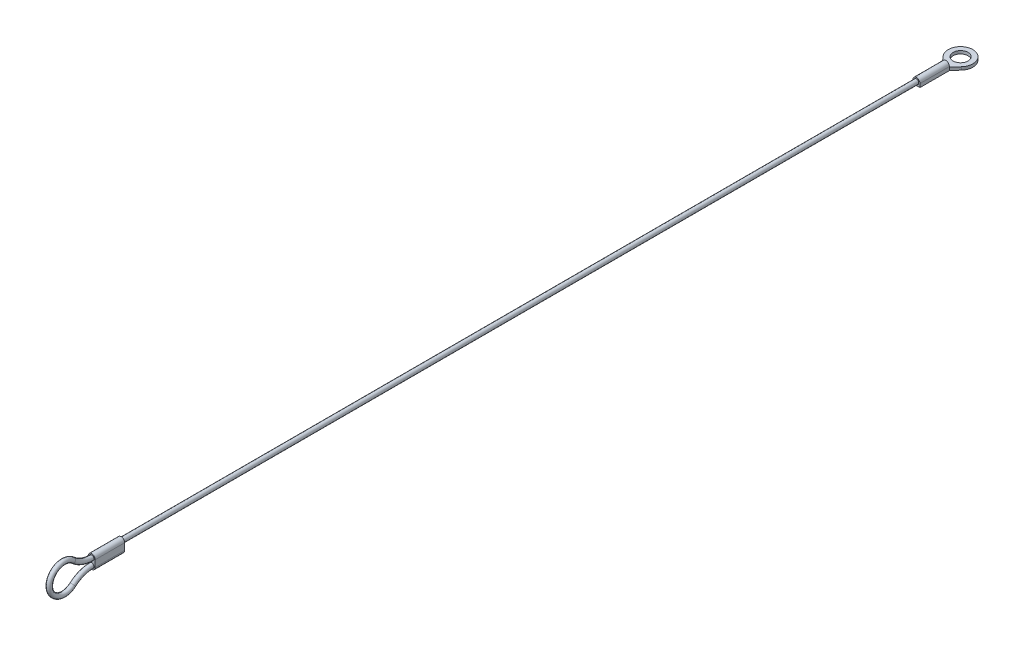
SolidWorks part; units mm, degrees
ref_plane "Front Plane" through (0, 0, 0) normal (0, 0, 1) x (1, 0, 0)
ref_plane "Top Plane" through (0, 0, 0) normal (0, 1, 0) x (1, 0, 0)
ref_plane "Right Plane" through (0, 0, 0) normal (1, 0, 0) x (0, 0, -1)
sketch "Sketch1" plane through (0, 0, 0) normal (1, 0, 0) x (0, 0, -1)
  line L2 (-280.2, 0) -> (0, 0)
  arc A0 (-280.2, 0) -> (-286.6, 2.4446) centre (-280.2, 9.6) cw
  arc A1 (-286.6, 2.4446) -> (-286.6, -4.7108) centre (-289.8, -1.1331) ccw
  arc A2 (-286.6, -4.7108) -> (-280.2, -2.2663) centre (-280.2, -11.8663) cw
  dimension "D1" = 4.8
  dimension "D4" = 9.6
  dimension "D2" = 289.8
  dimension "D3" = 9.6
sketch "Sketch2" plane through (0, 0, 0) normal (0, 0, 1) x (1, 0, 0)
  circle A0 centre (0, 0) radius 0.795
  dimension "D1" = 1.59
sweep "Sweep1" add profiles "Sketch2" path "Sketch1"
sketch "Sketch3" plane through (0, 0, 280.2) normal (0, 0, -1) x (-1, 0, 0)
  line L0 (0, 0) -> (0, -2.2663) construction
  line L1 (1.195, 0) -> (1.195, -2.2663)
  line L2 (-1.195, 0) -> (-1.195, -2.2663)
  line L3 (-0.795, -2.2663) -> (0.795, -2.2663) construction
  arc A0 (1.195, 0) -> (-1.195, 0) centre (0, 0) ccw
  arc A1 (-1.195, -2.2663) -> (1.195, -2.2663) centre (0, -2.2663) ccw
  point P3 (0, -1.1331)
  dimension "D1" = 2.39
extrude "Boss-Extrude1" add sketch "Sketch3" along normal blind 10
sketch "Sketch4" plane through (0, 0, 0) normal (0, 0, -1) x (-1, 0, 0)
  line L0 (-1.195, 0) -> (-1.195, -1.195)
  line L1 (-1.195, -1.195) -> (0, -1.195)
  line L2 (0, -1.195) -> (1.195, -1.195)
  line L3 (1.195, -1.195) -> (1.195, 0)
  arc A0 (1.195, 0) -> (-1.195, 0) centre (0, 0) ccw
  dimension "D1" = 2.39
extrude "Boss-Extrude2" add sketch "Sketch4" along normal blind 10
sketch "Sketch5" plane through (0, -1.195, 0) normal (0, -1, 0) x (1, 0, 0)
  line L0 (-1.195, -10) -> (1.195, -10)
  line L1 (1.195, -10) -> (3.155, -12.2428)
  line L2 (-3.155, -12.2428) -> (-1.195, -10)
  arc A0 (3.155, -12.2428) -> (-3.155, -12.2428) centre (0, -15) cw
  circle A1 centre (0, -15) radius 2.54
  point P8 (-4.19, -15)
  point P9 (4.19, -15)
  dimension "D1" = 5.08
  dimension "D2" = 8.38
  dimension "D3" = 15
extrude "Boss-Extrude3" add sketch "Sketch5" against normal blind 1.01
